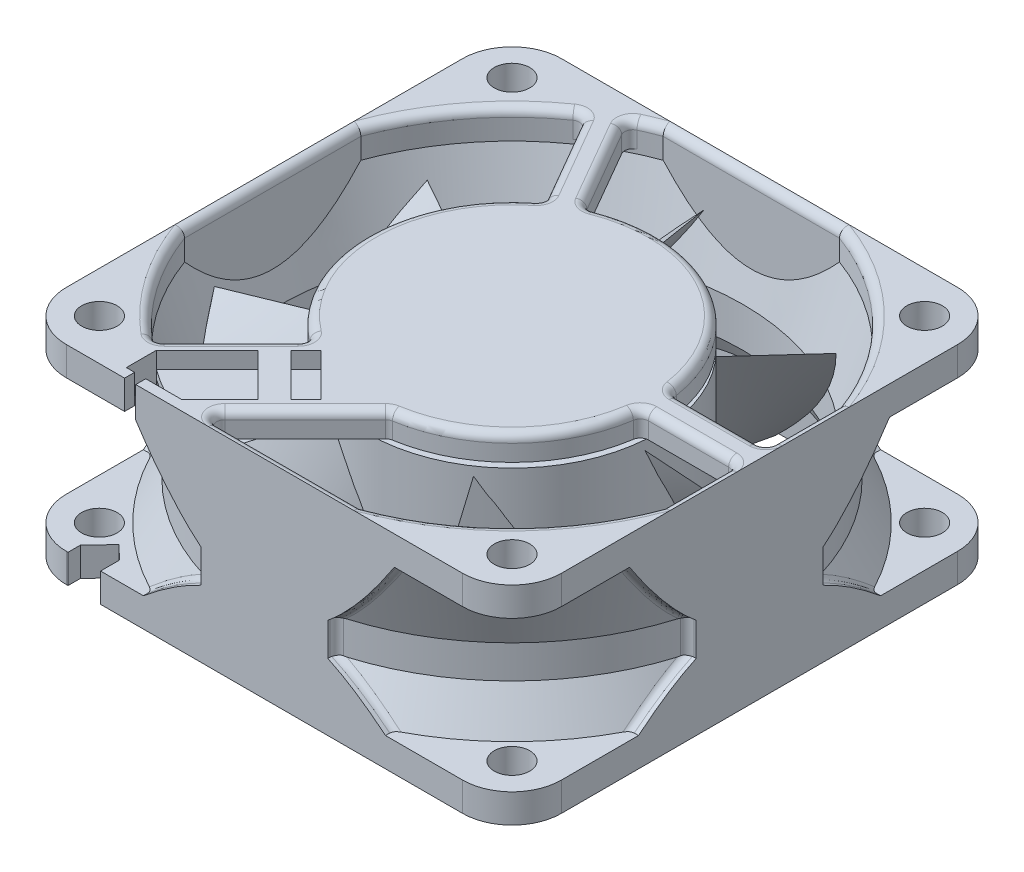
SolidWorks part; units mm, degrees
ref_plane "Alzado" through (0, 0, 0) normal (0, 0, 1) x (1, 0, 0)
ref_plane "Planta" through (0, 0, 0) normal (0, 1, 0) x (1, 0, 0)
ref_plane "Vista lateral" through (0, 0, 0) normal (1, 0, 0) x (0, 0, -1)
imported_body "ventola_1-1-surface1"
imported_body "ventola_2-1-surface1"
imported_body "ventola_2-1-surface2"
imported_body "ventola_2-1-surface3"
imported_body "ventola_2-1-surface4"
imported_body "ventola_2-1-surface5"
imported_body "ventola_2-1-surface6"
imported_body "ventola_2-1-surface7"
imported_body "ventola_2-1-surface8"
scale "Escala2" bodies to scale 109 108 107 106 105 104 103 102 101 scale about origin uniform scaling yes scale factor 0.62
